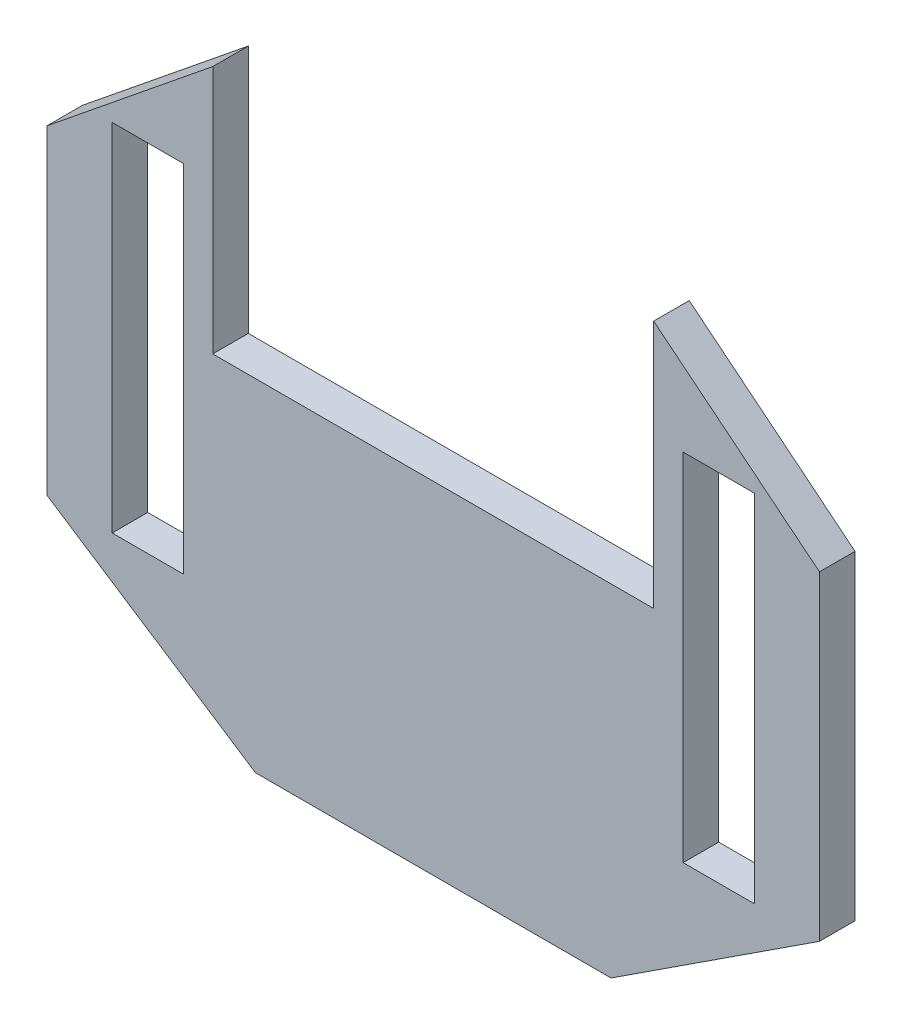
SolidWorks part; units mm, degrees
ref_plane "Plan de face" through (0, 0, 0) normal (0, 0, 1) x (1, 0, 0)
ref_plane "Plan de dessus" through (0, 0, 0) normal (0, 1, 0) x (1, 0, 0)
ref_plane "Plan de droite" through (0, 0, 0) normal (1, 0, 0) x (0, 0, -1)
sketch "Esquisse1" plane through (0, 0, 0) normal (0, 0, 1) x (1, 0, 0)
  line L0 (0, 0) -> (0, 152.6755) construction
  line L1 (62, 96) -> (-62, 96)
  line L2 (-62, 96) -> (-62, 166)
  line L3 (-62, 166) -> (-108.6302, 128.2426)
  line L4 (-108.6302, 128.2426) -> (-108.6302, 38.2426)
  line L5 (-108.6302, 38.2426) -> (-50, 0)
  line L6 (-50, 0) -> (50, 0)
  line L7 (70.2943, 138.2426) -> (70.2943, 38.2426)
  line L8 (90.2943, 38.2426) -> (70.2943, 38.2426)
  line L9 (90.2943, 138.2426) -> (90.2943, 38.2426)
  line L10 (90.2943, 138.2426) -> (70.2943, 138.2426)
  line L11 (108.6302, 38.2426) -> (50, 0)
  line L12 (-90.2943, 138.2426) -> (-70.2943, 138.2426)
  line L13 (-90.2943, 138.2426) -> (-90.2943, 38.2426)
  line L14 (-90.2943, 38.2426) -> (-70.2943, 38.2426)
  line L15 (-70.2943, 138.2426) -> (-70.2943, 38.2426)
  line L16 (108.6302, 128.2426) -> (108.6302, 38.2426)
  line L17 (62, 166) -> (108.6302, 128.2426)
  line L18 (62, 96) -> (62, 166)
  point P22 (0, 96)
  dimension "D1" = 50
  dimension "D2" = 90
  dimension "D3" = 70
  dimension "D4" = 62
  dimension "D5" = 70
  dimension "D6" = 60
  dimension "D7" = 166
  dimension "D10" = 100
  dimension "D11" = 20
extrude "Boss.-Extru.1" add sketch "Esquisse1" along normal blind 10
